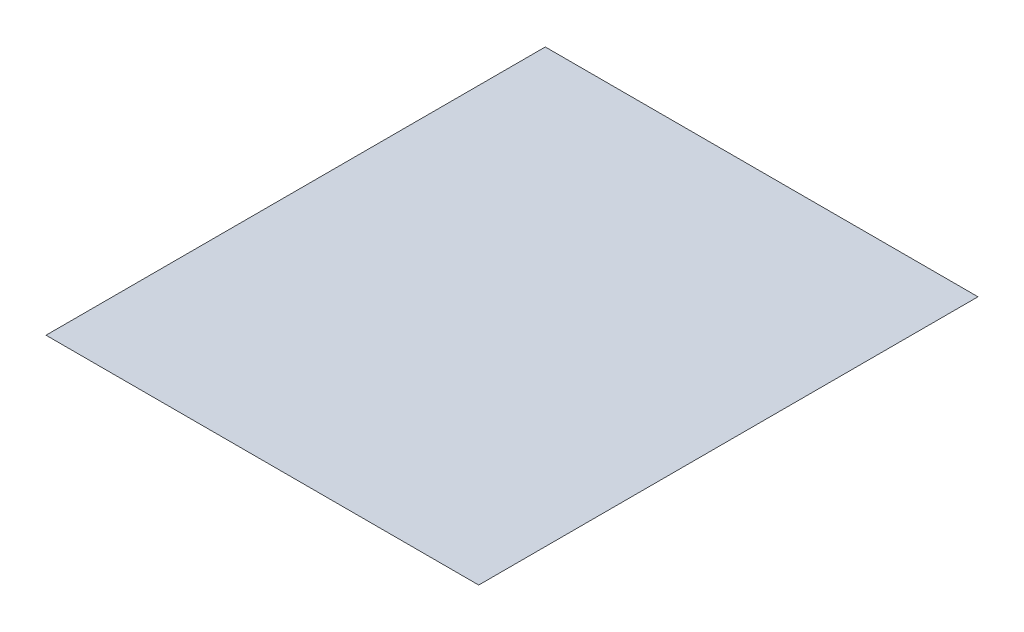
SolidWorks part; units mm, degrees
ref_plane "Alzado" through (0, 0, 0) normal (0, 0, 1) x (1, 0, 0)
ref_plane "Planta" through (0, 0, 0) normal (0, 1, 0) x (1, 0, 0)
ref_plane "Vista lateral" through (0, 0, 0) normal (1, 0, 0) x (0, 0, -1)
sketch "Croquis1" plane through (0, 0, 0) normal (0, 0, 1) x (1, 0, 0)
  line L0 (-48.8055, 0) -> (211.1945, 0)
  dimension "D1" = 260
surface "Superficie-Extruir1" sketch "Croquis1" parameters "D1"=300
